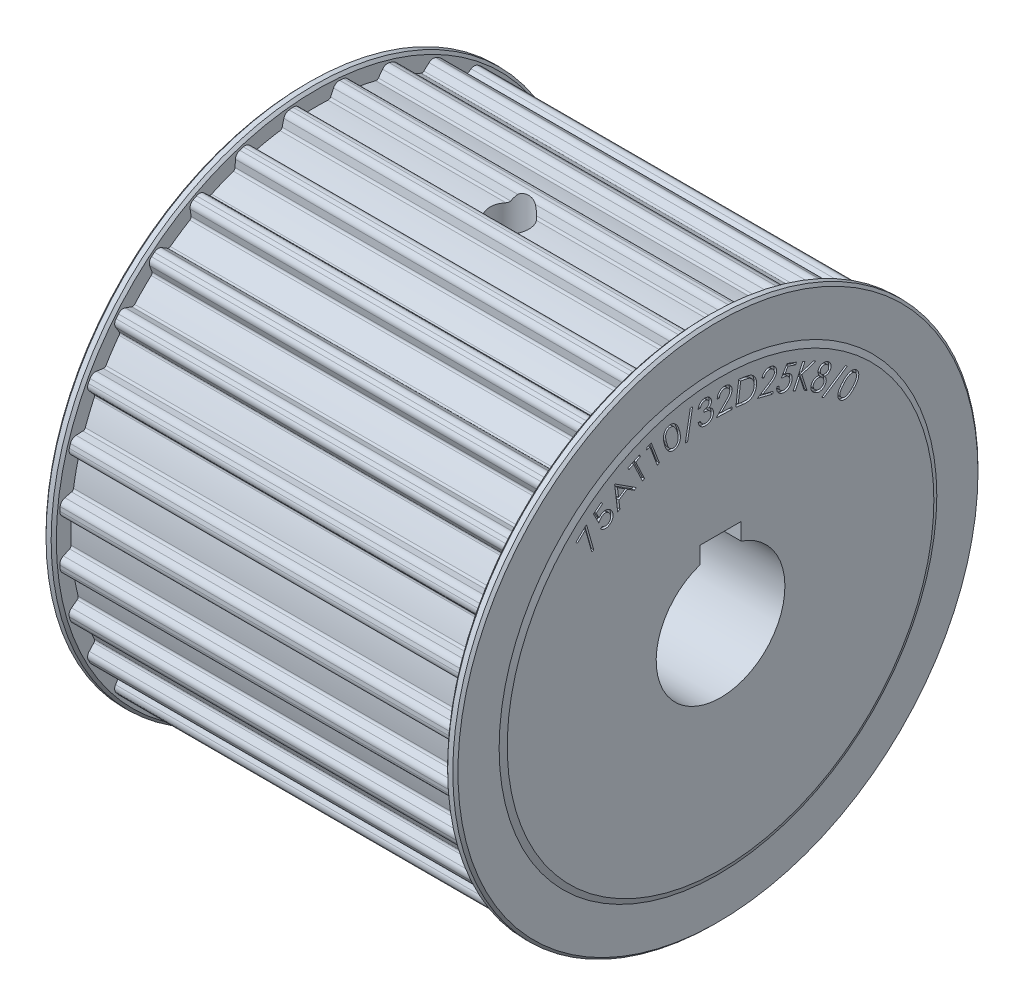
SolidWorks part; units mm, degrees
ref_plane "Front Plane" through (0, 0, 0) normal (0, 0, 1) x (1, 0, 0)
ref_plane "Top Plane" through (0, 0, 0) normal (0, 1, 0) x (1, 0, 0)
ref_plane "Right Plane" through (0, 0, 0) normal (1, 0, 0) x (0, 0, -1)
imported_body "Imported1"
sketch "Sketch1" plane through (-21, 0, 0) normal (-1, 0, 0) x (0, 0, 1)
  circle A0 centre (0, 0) radius 67.7057
extrude "Cut-Extrude1" cut sketch "Sketch1" against normal blind 0.5
sketch "Sketch2" plane through (17, 0, 0) normal (1, 0, 0) x (0, 0, -1)
  circle A0 centre (0, 0) radius 53.4254
extrude "Cut-Extrude2" cut sketch "Sketch2" against normal blind 0.5
fillet "Fillet1" radius 0.5 2 edges at (-20.5, 0, -50.5) (16.5, 0, 50.5)
ref_plane "Plane1" through (-12.5, 0, 0) normal (1, 0, 0) x (0, 0, -1)
sketch "Sketch3" plane through (-12.5, 0, 0) normal (1, 0, 0) x (0, 0, -1)
  circle A0 centre (0, 0) radius 53.7735
extrude "Cut-Extrude3" cut sketch "Sketch3" along normal blind 30
sketch "Sketch5" plane through (-12.5, 0, 0) normal (1, 0, 0) x (0, 0, -1)
  line L0 (4, 15.1427) -> (4, 11.8427) construction
  line L1 (-4, 15.1427) -> (4, 15.1427) construction
  line L2 (-4, 11.8427) -> (-4, 15.1427) construction
  line L3 (4, 15.1427) -> (4, 11.8427)
  line L4 (-4, 15.1427) -> (4, 15.1427)
  line L5 (-4, 11.8427) -> (-4, 15.1427)
  line L64 (-3.3393, -49.126) -> (-2.769, -47.903)
  line L65 (2.769, -47.903) -> (3.3393, -49.126)
  line L66 (6.3089, -48.8335) -> (6.6296, -47.5228)
  line L67 (12.0612, -46.4423) -> (12.8592, -47.5306)
  line L68 (15.7146, -46.6644) -> (15.7734, -45.3162)
  line L69 (20.8899, -43.1969) -> (21.8848, -44.1086)
  line L70 (24.5164, -42.702) -> (24.3111, -41.3683)
  line L71 (28.9158, -38.2915) -> (30.0695, -38.9916)
  line L72 (32.3761, -37.0986) -> (31.9145, -35.8305)
  line L73 (35.8305, -31.9145) -> (37.0986, -32.3761)
  line L74 (38.9916, -30.0695) -> (38.2915, -28.9158)
  line L75 (41.3683, -24.3111) -> (42.702, -24.5164)
  line L76 (44.1086, -21.8848) -> (43.1969, -20.8899)
  line L77 (45.3162, -15.7734) -> (46.6644, -15.7146)
  line L78 (47.5306, -12.8592) -> (46.4423, -12.0612)
  line L79 (47.5228, -6.6296) -> (48.8335, -6.3089)
  line L80 (49.126, -3.3393) -> (47.903, -2.769)
  line L81 (47.903, 2.769) -> (49.126, 3.3393)
  line L82 (48.8335, 6.3089) -> (47.5228, 6.6296)
  line L83 (46.4423, 12.0612) -> (47.5306, 12.8592)
  line L84 (46.6644, 15.7146) -> (45.3162, 15.7734)
  line L85 (43.1969, 20.8899) -> (44.1086, 21.8848)
  line L86 (42.702, 24.5164) -> (41.3683, 24.3111)
  line L87 (38.2915, 28.9158) -> (38.9916, 30.0695)
  line L88 (37.0986, 32.3761) -> (35.8305, 31.9145)
  line L89 (31.9145, 35.8305) -> (32.3761, 37.0986)
  line L90 (30.0695, 38.9916) -> (28.9158, 38.2915)
  line L91 (24.3111, 41.3683) -> (24.5164, 42.702)
  line L92 (21.8848, 44.1086) -> (20.8899, 43.1969)
  line L93 (15.7734, 45.3162) -> (15.7146, 46.6644)
  line L94 (12.8592, 47.5306) -> (12.0612, 46.4423)
  line L95 (6.6296, 47.5228) -> (6.3089, 48.8335)
  line L96 (3.3393, 49.126) -> (2.769, 47.903)
  line L97 (-2.769, 47.903) -> (-3.3393, 49.126)
  line L98 (-6.3089, 48.8335) -> (-6.6296, 47.5228)
  line L99 (-12.0612, 46.4423) -> (-12.8592, 47.5306)
  line L100 (-15.7146, 46.6644) -> (-15.7734, 45.3162)
  line L101 (-20.8899, 43.1969) -> (-21.8848, 44.1086)
  line L102 (-24.5164, 42.702) -> (-24.3111, 41.3683)
  line L103 (-28.9158, 38.2915) -> (-30.0695, 38.9916)
  line L104 (-32.3761, 37.0986) -> (-31.9145, 35.8305)
  line L105 (-35.8305, 31.9145) -> (-37.0986, 32.3761)
  line L106 (-38.9916, 30.0695) -> (-38.2915, 28.9158)
  line L107 (-41.3683, 24.3111) -> (-42.702, 24.5164)
  line L108 (-44.1086, 21.8848) -> (-43.1969, 20.8899)
  line L109 (-45.3162, 15.7734) -> (-46.6644, 15.7146)
  line L110 (-47.5306, 12.8592) -> (-46.4423, 12.0612)
  line L111 (-47.5228, 6.6296) -> (-48.8335, 6.3089)
  line L112 (-49.126, 3.3393) -> (-47.903, 2.769)
  line L113 (-47.903, -2.769) -> (-49.126, -3.3393)
  line L114 (-48.8335, -6.3089) -> (-47.5228, -6.6296)
  line L115 (-46.4423, -12.0612) -> (-47.5306, -12.8592)
  line L116 (-46.6644, -15.7146) -> (-45.3162, -15.7734)
  line L117 (-43.1969, -20.8899) -> (-44.1086, -21.8848)
  line L118 (-42.702, -24.5164) -> (-41.3683, -24.3111)
  line L119 (-38.2915, -28.9158) -> (-38.9916, -30.0695)
  line L120 (-37.0986, -32.3761) -> (-35.8305, -31.9145)
  line L121 (-31.9145, -35.8305) -> (-32.3761, -37.0986)
  line L122 (-30.0695, -38.9916) -> (-28.9158, -38.2915)
  line L123 (-24.3111, -41.3683) -> (-24.5164, -42.702)
  line L124 (-21.8848, -44.1086) -> (-20.8899, -43.1969)
  line L125 (-15.7734, -45.3162) -> (-15.7146, -46.6644)
  line L126 (-12.8592, -47.5306) -> (-12.0612, -46.4423)
  line L127 (-6.6296, -47.5228) -> (-6.3089, -48.8335)
  line L128 (-3.3393, -49.126) -> (-2.769, -47.903)
  line L129 (2.769, -47.903) -> (3.3393, -49.126)
  line L130 (6.3089, -48.8335) -> (6.6296, -47.5228)
  line L131 (12.0612, -46.4423) -> (12.8592, -47.5306)
  line L132 (15.7146, -46.6644) -> (15.7734, -45.3162)
  line L133 (20.8899, -43.1969) -> (21.8848, -44.1086)
  line L134 (24.5164, -42.702) -> (24.3111, -41.3683)
  line L135 (28.9158, -38.2915) -> (30.0695, -38.9916)
  line L136 (32.3761, -37.0986) -> (31.9145, -35.8305)
  line L137 (35.8305, -31.9145) -> (37.0986, -32.3761)
  line L138 (38.9916, -30.0695) -> (38.2915, -28.9158)
  line L139 (41.3683, -24.3111) -> (42.702, -24.5164)
  line L140 (44.1086, -21.8848) -> (43.1969, -20.8899)
  line L141 (45.3162, -15.7734) -> (46.6644, -15.7146)
  line L142 (47.5306, -12.8592) -> (46.4423, -12.0612)
  line L143 (47.5228, -6.6296) -> (48.8335, -6.3089)
  line L144 (49.126, -3.3393) -> (47.903, -2.769)
  line L145 (47.903, 2.769) -> (49.126, 3.3393)
  line L146 (48.8335, 6.3089) -> (47.5228, 6.6296)
  line L147 (46.4423, 12.0612) -> (47.5306, 12.8592)
  line L148 (46.6644, 15.7146) -> (45.3162, 15.7734)
  line L149 (43.1969, 20.8899) -> (44.1086, 21.8848)
  line L150 (42.702, 24.5164) -> (41.3683, 24.3111)
  line L151 (38.2915, 28.9158) -> (38.9916, 30.0695)
  line L152 (37.0986, 32.3761) -> (35.8305, 31.9145)
  line L153 (31.9145, 35.8305) -> (32.3761, 37.0986)
  line L154 (30.0695, 38.9916) -> (28.9158, 38.2915)
  line L155 (24.3111, 41.3683) -> (24.5164, 42.702)
  line L156 (21.8848, 44.1086) -> (20.8899, 43.1969)
  line L157 (15.7734, 45.3162) -> (15.7146, 46.6644)
  line L158 (12.8592, 47.5306) -> (12.0612, 46.4423)
  line L159 (6.6296, 47.5228) -> (6.3089, 48.8335)
  line L160 (3.3393, 49.126) -> (2.769, 47.903)
  line L161 (-2.769, 47.903) -> (-3.3393, 49.126)
  line L162 (-6.3089, 48.8335) -> (-6.6296, 47.5228)
  line L163 (-12.0612, 46.4423) -> (-12.8592, 47.5306)
  line L164 (-15.7146, 46.6644) -> (-15.7734, 45.3162)
  line L165 (-20.8899, 43.1969) -> (-21.8848, 44.1086)
  line L166 (-24.5164, 42.702) -> (-24.3111, 41.3683)
  line L167 (-28.9158, 38.2915) -> (-30.0695, 38.9916)
  line L168 (-32.3761, 37.0986) -> (-31.9145, 35.8305)
  line L169 (-35.8305, 31.9145) -> (-37.0986, 32.3761)
  line L170 (-38.9916, 30.0695) -> (-38.2915, 28.9158)
  line L171 (-41.3683, 24.3111) -> (-42.702, 24.5164)
  line L172 (-44.1086, 21.8848) -> (-43.1969, 20.8899)
  line L173 (-45.3162, 15.7734) -> (-46.6644, 15.7146)
  line L174 (-47.5306, 12.8592) -> (-46.4423, 12.0612)
  line L175 (-47.5228, 6.6296) -> (-48.8335, 6.3089)
  line L176 (-49.126, 3.3393) -> (-47.903, 2.769)
  line L177 (-47.903, -2.769) -> (-49.126, -3.3393)
  line L178 (-48.8335, -6.3089) -> (-47.5228, -6.6296)
  line L179 (-46.4423, -12.0612) -> (-47.5306, -12.8592)
  line L180 (-46.6644, -15.7146) -> (-45.3162, -15.7734)
  line L181 (-43.1969, -20.8899) -> (-44.1086, -21.8848)
  line L182 (-42.702, -24.5164) -> (-41.3683, -24.3111)
  line L183 (-38.2915, -28.9158) -> (-38.9916, -30.0695)
  line L184 (-37.0986, -32.3761) -> (-35.8305, -31.9145)
  line L185 (-31.9145, -35.8305) -> (-32.3761, -37.0986)
  line L186 (-30.0695, -38.9916) -> (-28.9158, -38.2915)
  line L187 (-24.3111, -41.3683) -> (-24.5164, -42.702)
  line L188 (-21.8848, -44.1086) -> (-20.8899, -43.1969)
  line L189 (-15.7734, -45.3162) -> (-15.7146, -46.6644)
  line L190 (-12.8592, -47.5306) -> (-12.0612, -46.4423)
  line L191 (-6.6296, -47.5228) -> (-6.3089, -48.8335)
  arc A0 (-4, 11.8427) -> (4, 11.8427) centre (0, 0) ccw construction
  arc A1 (-4, 11.8427) -> (4, 11.8427) centre (0, 0) ccw
  arc A192 (-2.2918, -47.6149) -> (-2.769, -47.903) centre (-2.3159, -48.1143) ccw
  arc A193 (-2.2918, -47.6149) -> (2.2918, -47.6149) centre (0, 0) ccw
  arc A194 (2.769, -47.903) -> (2.2918, -47.6149) centre (2.3159, -48.1143) ccw
  arc A195 (3.3393, -49.126) -> (4.5357, -49.8139) centre (4.4269, -48.6189) ccw
  arc A196 (4.5357, -49.8139) -> (5.2697, -49.7416) centre (0, 0) ccw
  arc A197 (5.2697, -49.7416) -> (6.3089, -48.8335) centre (5.1432, -48.5483) ccw
  arc A198 (7.0414, -47.1471) -> (6.6296, -47.5228) centre (7.1153, -47.6416) ccw
  arc A199 (7.0414, -47.1471) -> (11.537, -46.2529) centre (0, 0) ccw
  arc A200 (12.0612, -46.4423) -> (11.537, -46.2529) centre (11.658, -46.738) ccw
  arc A201 (12.8592, -47.5306) -> (14.1668, -47.9719) centre (13.8269, -46.821) ccw
  arc A202 (14.1668, -47.9719) -> (14.8725, -47.7578) centre (0, 0) ccw
  arc A203 (14.8725, -47.7578) -> (15.7146, -46.6644) centre (14.5157, -46.6121) ccw
  arc A204 (16.1041, -44.8675) -> (15.7734, -45.3162) centre (16.273, -45.3381) ccw
  arc A205 (16.1041, -44.8675) -> (20.3388, -43.1134) centre (0, 0) ccw
  arc A206 (20.8899, -43.1969) -> (20.3388, -43.1134) centre (20.5521, -43.5656) ccw
  arc A207 (21.8848, -44.1086) -> (23.2534, -44.2863) centre (22.6956, -43.2239) ccw
  arc A208 (23.2534, -44.2863) -> (23.9038, -43.9387) centre (0, 0) ccw
  arc A209 (23.9038, -43.9387) -> (24.5164, -42.702) centre (23.3304, -42.8846) ccw
  arc A210 (24.5478, -40.8636) -> (24.3111, -41.3683) centre (24.8053, -41.2922) ccw
  arc A211 (24.5478, -40.8636) -> (28.359, -38.3171) centre (0, 0) ccw
  arc A212 (28.9158, -38.2915) -> (28.359, -38.3171) centre (28.6564, -38.719) ccw
  arc A213 (30.0695, -38.9916) -> (31.4464, -38.8989) centre (30.692, -37.9657) ccw
  arc A214 (31.4464, -38.8989) -> (32.0165, -38.431) centre (0, 0) ccw
  arc A215 (32.0165, -38.431) -> (32.3761, -37.0986) centre (31.2485, -37.509) ccw
  arc A216 (32.0482, -35.2894) -> (31.9145, -35.8305) centre (32.3844, -35.6595) ccw
  arc A217 (32.0482, -35.2894) -> (35.2894, -32.0482) centre (0, 0) ccw
  arc A218 (35.8305, -31.9145) -> (35.2894, -32.0482) centre (35.6595, -32.3844) ccw
  arc A219 (37.0986, -32.3761) -> (38.431, -32.0165) centre (37.509, -31.2485) ccw
  arc A220 (38.431, -32.0165) -> (38.8989, -31.4464) centre (0, 0) ccw
  arc A221 (38.8989, -31.4464) -> (38.9916, -30.0695) centre (37.9657, -30.692) ccw
  arc A222 (38.3171, -28.359) -> (38.2915, -28.9158) centre (38.719, -28.6564) ccw
  arc A223 (38.3171, -28.359) -> (40.8636, -24.5478) centre (0, 0) ccw
  arc A224 (41.3683, -24.3111) -> (40.8636, -24.5478) centre (41.2922, -24.8053) ccw
  arc A225 (42.702, -24.5164) -> (43.9387, -23.9038) centre (42.8846, -23.3304) ccw
  arc A226 (43.9387, -23.9038) -> (44.2863, -23.2534) centre (0, 0) ccw
  arc A227 (44.2863, -23.2534) -> (44.1086, -21.8848) centre (43.2239, -22.6956) ccw
  arc A228 (43.1134, -20.3388) -> (43.1969, -20.8899) centre (43.5656, -20.5521) ccw
  arc A229 (43.1134, -20.3388) -> (44.8675, -16.1041) centre (0, 0) ccw
  arc A230 (45.3162, -15.7734) -> (44.8675, -16.1041) centre (45.3381, -16.273) ccw
  arc A231 (46.6644, -15.7146) -> (47.7578, -14.8725) centre (46.6121, -14.5157) ccw
  arc A232 (47.7578, -14.8725) -> (47.9719, -14.1668) centre (0, 0) ccw
  arc A233 (47.9719, -14.1668) -> (47.5306, -12.8592) centre (46.821, -13.8269) ccw
  arc A234 (46.2529, -11.537) -> (46.4423, -12.0612) centre (46.738, -11.658) ccw
  arc A235 (46.2529, -11.537) -> (47.1471, -7.0414) centre (0, 0) ccw
  arc A236 (47.5228, -6.6296) -> (47.1471, -7.0414) centre (47.6416, -7.1153) ccw
  arc A237 (48.8335, -6.3089) -> (49.7416, -5.2697) centre (48.5483, -5.1432) ccw
  arc A238 (49.7416, -5.2697) -> (49.8139, -4.5357) centre (0, 0) ccw
  arc A239 (49.8139, -4.5357) -> (49.126, -3.3393) centre (48.6189, -4.4269) ccw
  arc A240 (47.6149, -2.2918) -> (47.903, -2.769) centre (48.1143, -2.3159) ccw
  arc A241 (47.6149, -2.2918) -> (47.6149, 2.2918) centre (0, 0) ccw
  arc A242 (47.903, 2.769) -> (47.6149, 2.2918) centre (48.1143, 2.3159) ccw
  arc A243 (49.126, 3.3393) -> (49.8139, 4.5357) centre (48.6189, 4.4269) ccw
  arc A244 (49.8139, 4.5357) -> (49.7416, 5.2697) centre (0, 0) ccw
  arc A245 (49.7416, 5.2697) -> (48.8335, 6.3089) centre (48.5483, 5.1432) ccw
  arc A246 (47.1471, 7.0414) -> (47.5228, 6.6296) centre (47.6416, 7.1153) ccw
  arc A247 (47.1471, 7.0414) -> (46.2529, 11.537) centre (0, 0) ccw
  arc A248 (46.4423, 12.0612) -> (46.2529, 11.537) centre (46.738, 11.658) ccw
  arc A249 (47.5306, 12.8592) -> (47.9719, 14.1668) centre (46.821, 13.8269) ccw
  arc A250 (47.9719, 14.1668) -> (47.7578, 14.8725) centre (0, 0) ccw
  arc A251 (47.7578, 14.8725) -> (46.6644, 15.7146) centre (46.6121, 14.5157) ccw
  arc A252 (44.8675, 16.1041) -> (45.3162, 15.7734) centre (45.3381, 16.273) ccw
  arc A253 (44.8675, 16.1041) -> (43.1134, 20.3388) centre (0, 0) ccw
  arc A254 (43.1969, 20.8899) -> (43.1134, 20.3388) centre (43.5656, 20.5521) ccw
  arc A255 (44.1086, 21.8848) -> (44.2863, 23.2534) centre (43.2239, 22.6956) ccw
  arc A256 (44.2863, 23.2534) -> (43.9387, 23.9038) centre (0, 0) ccw
  arc A257 (43.9387, 23.9038) -> (42.702, 24.5164) centre (42.8846, 23.3304) ccw
  arc A258 (40.8636, 24.5478) -> (41.3683, 24.3111) centre (41.2922, 24.8053) ccw
  arc A259 (40.8636, 24.5478) -> (38.3171, 28.359) centre (0, 0) ccw
  arc A260 (38.2915, 28.9158) -> (38.3171, 28.359) centre (38.719, 28.6564) ccw
  arc A261 (38.9916, 30.0695) -> (38.8989, 31.4464) centre (37.9657, 30.692) ccw
  arc A262 (38.8989, 31.4464) -> (38.431, 32.0165) centre (0, 0) ccw
  arc A263 (38.431, 32.0165) -> (37.0986, 32.3761) centre (37.509, 31.2485) ccw
  arc A264 (35.2894, 32.0482) -> (35.8305, 31.9145) centre (35.6595, 32.3844) ccw
  arc A265 (35.2894, 32.0482) -> (32.0482, 35.2894) centre (0, 0) ccw
  arc A266 (31.9145, 35.8305) -> (32.0482, 35.2894) centre (32.3844, 35.6595) ccw
  arc A267 (32.3761, 37.0986) -> (32.0165, 38.431) centre (31.2485, 37.509) ccw
  arc A268 (32.0165, 38.431) -> (31.4464, 38.8989) centre (0, 0) ccw
  arc A269 (31.4464, 38.8989) -> (30.0695, 38.9916) centre (30.692, 37.9657) ccw
  arc A270 (28.359, 38.3171) -> (28.9158, 38.2915) centre (28.6564, 38.719) ccw
  arc A271 (28.359, 38.3171) -> (24.5478, 40.8636) centre (0, 0) ccw
  arc A272 (24.3111, 41.3683) -> (24.5478, 40.8636) centre (24.8053, 41.2922) ccw
  arc A273 (24.5164, 42.702) -> (23.9038, 43.9387) centre (23.3304, 42.8846) ccw
  arc A274 (23.9038, 43.9387) -> (23.2534, 44.2863) centre (0, 0) ccw
  arc A275 (23.2534, 44.2863) -> (21.8848, 44.1086) centre (22.6956, 43.2239) ccw
  arc A276 (20.3388, 43.1134) -> (20.8899, 43.1969) centre (20.5521, 43.5656) ccw
  arc A277 (20.3388, 43.1134) -> (16.1041, 44.8675) centre (0, 0) ccw
  arc A278 (15.7734, 45.3162) -> (16.1041, 44.8675) centre (16.273, 45.3381) ccw
  arc A279 (15.7146, 46.6644) -> (14.8725, 47.7578) centre (14.5157, 46.6121) ccw
  arc A280 (14.8725, 47.7578) -> (14.1668, 47.9719) centre (0, 0) ccw
  arc A281 (14.1668, 47.9719) -> (12.8592, 47.5306) centre (13.8269, 46.821) ccw
  arc A282 (11.537, 46.2529) -> (12.0612, 46.4423) centre (11.658, 46.738) ccw
  arc A283 (11.537, 46.2529) -> (7.0414, 47.1471) centre (0, 0) ccw
  arc A284 (6.6296, 47.5228) -> (7.0414, 47.1471) centre (7.1153, 47.6416) ccw
  arc A285 (6.3089, 48.8335) -> (5.2697, 49.7416) centre (5.1432, 48.5483) ccw
  arc A286 (5.2697, 49.7416) -> (4.5357, 49.8139) centre (0, 0) ccw
  arc A287 (4.5357, 49.8139) -> (3.3393, 49.126) centre (4.4269, 48.6189) ccw
  arc A288 (2.2918, 47.6149) -> (2.769, 47.903) centre (2.3159, 48.1143) ccw
  arc A289 (2.2918, 47.6149) -> (-2.2918, 47.6149) centre (0, 0) ccw
  arc A290 (-2.769, 47.903) -> (-2.2918, 47.6149) centre (-2.3159, 48.1143) ccw
  arc A291 (-3.3393, 49.126) -> (-4.5357, 49.8139) centre (-4.4269, 48.6189) ccw
  arc A292 (-4.5357, 49.8139) -> (-5.2697, 49.7416) centre (0, 0) ccw
  arc A293 (-5.2697, 49.7416) -> (-6.3089, 48.8335) centre (-5.1432, 48.5483) ccw
  arc A294 (-7.0414, 47.1471) -> (-6.6296, 47.5228) centre (-7.1153, 47.6416) ccw
  arc A295 (-7.0414, 47.1471) -> (-11.537, 46.2529) centre (0, 0) ccw
  arc A296 (-12.0612, 46.4423) -> (-11.537, 46.2529) centre (-11.658, 46.738) ccw
  arc A297 (-12.8592, 47.5306) -> (-14.1668, 47.9719) centre (-13.8269, 46.821) ccw
  arc A298 (-14.1668, 47.9719) -> (-14.8725, 47.7578) centre (0, 0) ccw
  arc A299 (-14.8725, 47.7578) -> (-15.7146, 46.6644) centre (-14.5157, 46.6121) ccw
  arc A300 (-16.1041, 44.8675) -> (-15.7734, 45.3162) centre (-16.273, 45.3381) ccw
  arc A301 (-16.1041, 44.8675) -> (-20.3388, 43.1134) centre (0, 0) ccw
  arc A302 (-20.8899, 43.1969) -> (-20.3388, 43.1134) centre (-20.5521, 43.5656) ccw
  arc A303 (-21.8848, 44.1086) -> (-23.2534, 44.2863) centre (-22.6956, 43.2239) ccw
  arc A304 (-23.2534, 44.2863) -> (-23.9038, 43.9387) centre (0, 0) ccw
  arc A305 (-23.9038, 43.9387) -> (-24.5164, 42.702) centre (-23.3304, 42.8846) ccw
  arc A306 (-24.5478, 40.8636) -> (-24.3111, 41.3683) centre (-24.8053, 41.2922) ccw
  arc A307 (-24.5478, 40.8636) -> (-28.359, 38.3171) centre (0, 0) ccw
  arc A308 (-28.9158, 38.2915) -> (-28.359, 38.3171) centre (-28.6564, 38.719) ccw
  arc A309 (-30.0695, 38.9916) -> (-31.4464, 38.8989) centre (-30.692, 37.9657) ccw
  arc A310 (-31.4464, 38.8989) -> (-32.0165, 38.431) centre (0, 0) ccw
  arc A311 (-32.0165, 38.431) -> (-32.3761, 37.0986) centre (-31.2485, 37.509) ccw
  arc A312 (-32.0482, 35.2894) -> (-31.9145, 35.8305) centre (-32.3844, 35.6595) ccw
  arc A313 (-32.0482, 35.2894) -> (-35.2894, 32.0482) centre (0, 0) ccw
  arc A314 (-35.8305, 31.9145) -> (-35.2894, 32.0482) centre (-35.6595, 32.3844) ccw
  arc A315 (-37.0986, 32.3761) -> (-38.431, 32.0165) centre (-37.509, 31.2485) ccw
  arc A316 (-38.431, 32.0165) -> (-38.8989, 31.4464) centre (0, 0) ccw
  arc A317 (-38.8989, 31.4464) -> (-38.9916, 30.0695) centre (-37.9657, 30.692) ccw
  arc A318 (-38.3171, 28.359) -> (-38.2915, 28.9158) centre (-38.719, 28.6564) ccw
  arc A319 (-38.3171, 28.359) -> (-40.8636, 24.5478) centre (0, 0) ccw
  arc A320 (-41.3683, 24.3111) -> (-40.8636, 24.5478) centre (-41.2922, 24.8053) ccw
  arc A321 (-42.702, 24.5164) -> (-43.9387, 23.9038) centre (-42.8846, 23.3304) ccw
  arc A322 (-43.9387, 23.9038) -> (-44.2863, 23.2534) centre (0, 0) ccw
  arc A323 (-44.2863, 23.2534) -> (-44.1086, 21.8848) centre (-43.2239, 22.6956) ccw
  arc A324 (-43.1134, 20.3388) -> (-43.1969, 20.8899) centre (-43.5656, 20.5521) ccw
  arc A325 (-43.1134, 20.3388) -> (-44.8675, 16.1041) centre (0, 0) ccw
  arc A326 (-45.3162, 15.7734) -> (-44.8675, 16.1041) centre (-45.3381, 16.273) ccw
  arc A327 (-46.6644, 15.7146) -> (-47.7578, 14.8725) centre (-46.6121, 14.5157) ccw
  arc A328 (-47.7578, 14.8725) -> (-47.9719, 14.1668) centre (0, 0) ccw
  arc A329 (-47.9719, 14.1668) -> (-47.5306, 12.8592) centre (-46.821, 13.8269) ccw
  arc A330 (-46.2529, 11.537) -> (-46.4423, 12.0612) centre (-46.738, 11.658) ccw
  arc A331 (-46.2529, 11.537) -> (-47.1471, 7.0414) centre (0, 0) ccw
  arc A332 (-47.5228, 6.6296) -> (-47.1471, 7.0414) centre (-47.6416, 7.1153) ccw
  arc A333 (-48.8335, 6.3089) -> (-49.7416, 5.2697) centre (-48.5483, 5.1432) ccw
  arc A334 (-49.7416, 5.2697) -> (-49.8139, 4.5357) centre (0, 0) ccw
  arc A335 (-49.8139, 4.5357) -> (-49.126, 3.3393) centre (-48.6189, 4.4269) ccw
  arc A336 (-47.6149, 2.2918) -> (-47.903, 2.769) centre (-48.1143, 2.3159) ccw
  arc A337 (-47.6149, 2.2918) -> (-47.6149, -2.2918) centre (0, 0) ccw
  arc A338 (-47.903, -2.769) -> (-47.6149, -2.2918) centre (-48.1143, -2.3159) ccw
  arc A339 (-49.126, -3.3393) -> (-49.8139, -4.5357) centre (-48.6189, -4.4269) ccw
  arc A340 (-49.8139, -4.5357) -> (-49.7416, -5.2697) centre (0, 0) ccw
  arc A341 (-49.7416, -5.2697) -> (-48.8335, -6.3089) centre (-48.5483, -5.1432) ccw
  arc A342 (-47.1471, -7.0414) -> (-47.5228, -6.6296) centre (-47.6416, -7.1153) ccw
  arc A343 (-47.1471, -7.0414) -> (-46.2529, -11.537) centre (0, 0) ccw
  arc A344 (-46.4423, -12.0612) -> (-46.2529, -11.537) centre (-46.738, -11.658) ccw
  arc A345 (-47.5306, -12.8592) -> (-47.9719, -14.1668) centre (-46.821, -13.8269) ccw
  arc A346 (-47.9719, -14.1668) -> (-47.7578, -14.8725) centre (0, 0) ccw
  arc A347 (-47.7578, -14.8725) -> (-46.6644, -15.7146) centre (-46.6121, -14.5157) ccw
  arc A348 (-44.8675, -16.1041) -> (-45.3162, -15.7734) centre (-45.3381, -16.273) ccw
  arc A349 (-44.8675, -16.1041) -> (-43.1134, -20.3388) centre (0, 0) ccw
  arc A350 (-43.1969, -20.8899) -> (-43.1134, -20.3388) centre (-43.5656, -20.5521) ccw
  arc A351 (-44.1086, -21.8848) -> (-44.2863, -23.2534) centre (-43.2239, -22.6956) ccw
  arc A352 (-44.2863, -23.2534) -> (-43.9387, -23.9038) centre (0, 0) ccw
  arc A353 (-43.9387, -23.9038) -> (-42.702, -24.5164) centre (-42.8846, -23.3304) ccw
  arc A354 (-40.8636, -24.5478) -> (-41.3683, -24.3111) centre (-41.2922, -24.8053) ccw
  arc A355 (-40.8636, -24.5478) -> (-38.3171, -28.359) centre (0, 0) ccw
  arc A356 (-38.2915, -28.9158) -> (-38.3171, -28.359) centre (-38.719, -28.6564) ccw
  arc A357 (-38.9916, -30.0695) -> (-38.8989, -31.4464) centre (-37.9657, -30.692) ccw
  arc A358 (-38.8989, -31.4464) -> (-38.431, -32.0165) centre (0, 0) ccw
  arc A359 (-38.431, -32.0165) -> (-37.0986, -32.3761) centre (-37.509, -31.2485) ccw
  arc A360 (-35.2894, -32.0482) -> (-35.8305, -31.9145) centre (-35.6595, -32.3844) ccw
  arc A361 (-35.2894, -32.0482) -> (-32.0482, -35.2894) centre (0, 0) ccw
  arc A362 (-31.9145, -35.8305) -> (-32.0482, -35.2894) centre (-32.3844, -35.6595) ccw
  arc A363 (-32.3761, -37.0986) -> (-32.0165, -38.431) centre (-31.2485, -37.509) ccw
  arc A364 (-32.0165, -38.431) -> (-31.4464, -38.8989) centre (0, 0) ccw
  arc A365 (-31.4464, -38.8989) -> (-30.0695, -38.9916) centre (-30.692, -37.9657) ccw
  arc A366 (-28.359, -38.3171) -> (-28.9158, -38.2915) centre (-28.6564, -38.719) ccw
  arc A367 (-28.359, -38.3171) -> (-24.5478, -40.8636) centre (0, 0) ccw
  arc A368 (-24.3111, -41.3683) -> (-24.5478, -40.8636) centre (-24.8053, -41.2922) ccw
  arc A369 (-24.5164, -42.702) -> (-23.9038, -43.9387) centre (-23.3304, -42.8846) ccw
  arc A370 (-23.9038, -43.9387) -> (-23.2534, -44.2863) centre (0, 0) ccw
  arc A371 (-23.2534, -44.2863) -> (-21.8848, -44.1086) centre (-22.6956, -43.2239) ccw
  arc A372 (-20.3388, -43.1134) -> (-20.8899, -43.1969) centre (-20.5521, -43.5656) ccw
  arc A373 (-20.3388, -43.1134) -> (-16.1041, -44.8675) centre (0, 0) ccw
  arc A374 (-15.7734, -45.3162) -> (-16.1041, -44.8675) centre (-16.273, -45.3381) ccw
  arc A375 (-15.7146, -46.6644) -> (-14.8725, -47.7578) centre (-14.5157, -46.6121) ccw
  arc A376 (-14.8725, -47.7578) -> (-14.1668, -47.9719) centre (0, 0) ccw
  arc A377 (-14.1668, -47.9719) -> (-12.8592, -47.5306) centre (-13.8269, -46.821) ccw
  arc A378 (-11.537, -46.2529) -> (-12.0612, -46.4423) centre (-11.658, -46.738) ccw
  arc A379 (-11.537, -46.2529) -> (-7.0414, -47.1471) centre (0, 0) ccw
  arc A380 (-6.6296, -47.5228) -> (-7.0414, -47.1471) centre (-7.1153, -47.6416) ccw
  arc A381 (-6.3089, -48.8335) -> (-5.2697, -49.7416) centre (-5.1432, -48.5483) ccw
  arc A382 (-5.2697, -49.7416) -> (-4.5357, -49.8139) centre (0, 0) ccw
  arc A383 (-4.5357, -49.8139) -> (-3.3393, -49.126) centre (-4.4269, -48.6189) ccw
  arc A384 (-2.2918, -47.6149) -> (-2.769, -47.903) centre (-2.3159, -48.1143) ccw
  arc A385 (-2.2918, -47.6149) -> (2.2918, -47.6149) centre (0, 0) ccw
  arc A386 (2.769, -47.903) -> (2.2918, -47.6149) centre (2.3159, -48.1143) ccw
  arc A387 (3.3393, -49.126) -> (4.5357, -49.8139) centre (4.4269, -48.6189) ccw
  arc A388 (4.5357, -49.8139) -> (5.2697, -49.7416) centre (0, 0) ccw
  arc A389 (5.2697, -49.7416) -> (6.3089, -48.8335) centre (5.1432, -48.5483) ccw
  arc A390 (7.0414, -47.1471) -> (6.6296, -47.5228) centre (7.1153, -47.6416) ccw
  arc A391 (7.0414, -47.1471) -> (11.537, -46.2529) centre (0, 0) ccw
  arc A392 (12.0612, -46.4423) -> (11.537, -46.2529) centre (11.658, -46.738) ccw
  arc A393 (12.8592, -47.5306) -> (14.1668, -47.9719) centre (13.8269, -46.821) ccw
  arc A394 (14.1668, -47.9719) -> (14.8725, -47.7578) centre (0, 0) ccw
  arc A395 (14.8725, -47.7578) -> (15.7146, -46.6644) centre (14.5157, -46.6121) ccw
  arc A396 (16.1041, -44.8675) -> (15.7734, -45.3162) centre (16.273, -45.3381) ccw
  arc A397 (16.1041, -44.8675) -> (20.3388, -43.1134) centre (0, 0) ccw
  arc A398 (20.8899, -43.1969) -> (20.3388, -43.1134) centre (20.5521, -43.5656) ccw
  arc A399 (21.8848, -44.1086) -> (23.2534, -44.2863) centre (22.6956, -43.2239) ccw
  arc A400 (23.2534, -44.2863) -> (23.9038, -43.9387) centre (0, 0) ccw
  arc A401 (23.9038, -43.9387) -> (24.5164, -42.702) centre (23.3304, -42.8846) ccw
  arc A402 (24.5478, -40.8636) -> (24.3111, -41.3683) centre (24.8053, -41.2922) ccw
  arc A403 (24.5478, -40.8636) -> (28.359, -38.3171) centre (0, 0) ccw
  arc A404 (28.9158, -38.2915) -> (28.359, -38.3171) centre (28.6564, -38.719) ccw
  arc A405 (30.0695, -38.9916) -> (31.4464, -38.8989) centre (30.692, -37.9657) ccw
  arc A406 (31.4464, -38.8989) -> (32.0165, -38.431) centre (0, 0) ccw
  arc A407 (32.0165, -38.431) -> (32.3761, -37.0986) centre (31.2485, -37.509) ccw
  arc A408 (32.0482, -35.2894) -> (31.9145, -35.8305) centre (32.3844, -35.6595) ccw
  arc A409 (32.0482, -35.2894) -> (35.2894, -32.0482) centre (0, 0) ccw
  arc A410 (35.8305, -31.9145) -> (35.2894, -32.0482) centre (35.6595, -32.3844) ccw
  arc A411 (37.0986, -32.3761) -> (38.431, -32.0165) centre (37.509, -31.2485) ccw
  arc A412 (38.431, -32.0165) -> (38.8989, -31.4464) centre (0, 0) ccw
  arc A413 (38.8989, -31.4464) -> (38.9916, -30.0695) centre (37.9657, -30.692) ccw
  arc A414 (38.3171, -28.359) -> (38.2915, -28.9158) centre (38.719, -28.6564) ccw
  arc A415 (38.3171, -28.359) -> (40.8636, -24.5478) centre (0, 0) ccw
  arc A416 (41.3683, -24.3111) -> (40.8636, -24.5478) centre (41.2922, -24.8053) ccw
  arc A417 (42.702, -24.5164) -> (43.9387, -23.9038) centre (42.8846, -23.3304) ccw
  arc A418 (43.9387, -23.9038) -> (44.2863, -23.2534) centre (0, 0) ccw
  arc A419 (44.2863, -23.2534) -> (44.1086, -21.8848) centre (43.2239, -22.6956) ccw
  arc A420 (43.1134, -20.3388) -> (43.1969, -20.8899) centre (43.5656, -20.5521) ccw
  arc A421 (43.1134, -20.3388) -> (44.8675, -16.1041) centre (0, 0) ccw
  arc A422 (45.3162, -15.7734) -> (44.8675, -16.1041) centre (45.3381, -16.273) ccw
  arc A423 (46.6644, -15.7146) -> (47.7578, -14.8725) centre (46.6121, -14.5157) ccw
  arc A424 (47.7578, -14.8725) -> (47.9719, -14.1668) centre (0, 0) ccw
  arc A425 (47.9719, -14.1668) -> (47.5306, -12.8592) centre (46.821, -13.8269) ccw
  arc A426 (46.2529, -11.537) -> (46.4423, -12.0612) centre (46.738, -11.658) ccw
  arc A427 (46.2529, -11.537) -> (47.1471, -7.0414) centre (0, 0) ccw
  arc A428 (47.5228, -6.6296) -> (47.1471, -7.0414) centre (47.6416, -7.1153) ccw
  arc A429 (48.8335, -6.3089) -> (49.7416, -5.2697) centre (48.5483, -5.1432) ccw
  arc A430 (49.7416, -5.2697) -> (49.8139, -4.5357) centre (0, 0) ccw
  arc A431 (49.8139, -4.5357) -> (49.126, -3.3393) centre (48.6189, -4.4269) ccw
  arc A432 (47.6149, -2.2918) -> (47.903, -2.769) centre (48.1143, -2.3159) ccw
  arc A433 (47.6149, -2.2918) -> (47.6149, 2.2918) centre (0, 0) ccw
  arc A434 (47.903, 2.769) -> (47.6149, 2.2918) centre (48.1143, 2.3159) ccw
  arc A435 (49.126, 3.3393) -> (49.8139, 4.5357) centre (48.6189, 4.4269) ccw
  arc A436 (49.8139, 4.5357) -> (49.7416, 5.2697) centre (0, 0) ccw
  arc A437 (49.7416, 5.2697) -> (48.8335, 6.3089) centre (48.5483, 5.1432) ccw
  arc A438 (47.1471, 7.0414) -> (47.5228, 6.6296) centre (47.6416, 7.1153) ccw
  arc A439 (47.1471, 7.0414) -> (46.2529, 11.537) centre (0, 0) ccw
  arc A440 (46.4423, 12.0612) -> (46.2529, 11.537) centre (46.738, 11.658) ccw
  arc A441 (47.5306, 12.8592) -> (47.9719, 14.1668) centre (46.821, 13.8269) ccw
  arc A442 (47.9719, 14.1668) -> (47.7578, 14.8725) centre (0, 0) ccw
  arc A443 (47.7578, 14.8725) -> (46.6644, 15.7146) centre (46.6121, 14.5157) ccw
  arc A444 (44.8675, 16.1041) -> (45.3162, 15.7734) centre (45.3381, 16.273) ccw
  arc A445 (44.8675, 16.1041) -> (43.1134, 20.3388) centre (0, 0) ccw
  arc A446 (43.1969, 20.8899) -> (43.1134, 20.3388) centre (43.5656, 20.5521) ccw
  arc A447 (44.1086, 21.8848) -> (44.2863, 23.2534) centre (43.2239, 22.6956) ccw
  arc A448 (44.2863, 23.2534) -> (43.9387, 23.9038) centre (0, 0) ccw
  arc A449 (43.9387, 23.9038) -> (42.702, 24.5164) centre (42.8846, 23.3304) ccw
  arc A450 (40.8636, 24.5478) -> (41.3683, 24.3111) centre (41.2922, 24.8053) ccw
  arc A451 (40.8636, 24.5478) -> (38.3171, 28.359) centre (0, 0) ccw
  arc A452 (38.2915, 28.9158) -> (38.3171, 28.359) centre (38.719, 28.6564) ccw
  arc A453 (38.9916, 30.0695) -> (38.8989, 31.4464) centre (37.9657, 30.692) ccw
  arc A454 (38.8989, 31.4464) -> (38.431, 32.0165) centre (0, 0) ccw
  arc A455 (38.431, 32.0165) -> (37.0986, 32.3761) centre (37.509, 31.2485) ccw
  arc A456 (35.2894, 32.0482) -> (35.8305, 31.9145) centre (35.6595, 32.3844) ccw
  arc A457 (35.2894, 32.0482) -> (32.0482, 35.2894) centre (0, 0) ccw
  arc A458 (31.9145, 35.8305) -> (32.0482, 35.2894) centre (32.3844, 35.6595) ccw
  arc A459 (32.3761, 37.0986) -> (32.0165, 38.431) centre (31.2485, 37.509) ccw
  arc A460 (32.0165, 38.431) -> (31.4464, 38.8989) centre (0, 0) ccw
  arc A461 (31.4464, 38.8989) -> (30.0695, 38.9916) centre (30.692, 37.9657) ccw
  arc A462 (28.359, 38.3171) -> (28.9158, 38.2915) centre (28.6564, 38.719) ccw
  arc A463 (28.359, 38.3171) -> (24.5478, 40.8636) centre (0, 0) ccw
  arc A464 (24.3111, 41.3683) -> (24.5478, 40.8636) centre (24.8053, 41.2922) ccw
  arc A465 (24.5164, 42.702) -> (23.9038, 43.9387) centre (23.3304, 42.8846) ccw
  arc A466 (23.9038, 43.9387) -> (23.2534, 44.2863) centre (0, 0) ccw
  arc A467 (23.2534, 44.2863) -> (21.8848, 44.1086) centre (22.6956, 43.2239) ccw
  arc A468 (20.3388, 43.1134) -> (20.8899, 43.1969) centre (20.5521, 43.5656) ccw
  arc A469 (20.3388, 43.1134) -> (16.1041, 44.8675) centre (0, 0) ccw
  arc A470 (15.7734, 45.3162) -> (16.1041, 44.8675) centre (16.273, 45.3381) ccw
  arc A471 (15.7146, 46.6644) -> (14.8725, 47.7578) centre (14.5157, 46.6121) ccw
  arc A472 (14.8725, 47.7578) -> (14.1668, 47.9719) centre (0, 0) ccw
  arc A473 (14.1668, 47.9719) -> (12.8592, 47.5306) centre (13.8269, 46.821) ccw
  arc A474 (11.537, 46.2529) -> (12.0612, 46.4423) centre (11.658, 46.738) ccw
  arc A475 (11.537, 46.2529) -> (7.0414, 47.1471) centre (0, 0) ccw
  arc A476 (6.6296, 47.5228) -> (7.0414, 47.1471) centre (7.1153, 47.6416) ccw
  arc A477 (6.3089, 48.8335) -> (5.2697, 49.7416) centre (5.1432, 48.5483) ccw
  arc A478 (5.2697, 49.7416) -> (4.5357, 49.8139) centre (0, 0) ccw
  arc A479 (4.5357, 49.8139) -> (3.3393, 49.126) centre (4.4269, 48.6189) ccw
  arc A480 (2.2918, 47.6149) -> (2.769, 47.903) centre (2.3159, 48.1143) ccw
  arc A481 (2.2918, 47.6149) -> (-2.2918, 47.6149) centre (0, 0) ccw
  arc A482 (-2.769, 47.903) -> (-2.2918, 47.6149) centre (-2.3159, 48.1143) ccw
  arc A483 (-3.3393, 49.126) -> (-4.5357, 49.8139) centre (-4.4269, 48.6189) ccw
  arc A484 (-4.5357, 49.8139) -> (-5.2697, 49.7416) centre (0, 0) ccw
  arc A485 (-5.2697, 49.7416) -> (-6.3089, 48.8335) centre (-5.1432, 48.5483) ccw
  arc A486 (-7.0414, 47.1471) -> (-6.6296, 47.5228) centre (-7.1153, 47.6416) ccw
  arc A487 (-7.0414, 47.1471) -> (-11.537, 46.2529) centre (0, 0) ccw
  arc A488 (-12.0612, 46.4423) -> (-11.537, 46.2529) centre (-11.658, 46.738) ccw
  arc A489 (-12.8592, 47.5306) -> (-14.1668, 47.9719) centre (-13.8269, 46.821) ccw
  arc A490 (-14.1668, 47.9719) -> (-14.8725, 47.7578) centre (0, 0) ccw
  arc A491 (-14.8725, 47.7578) -> (-15.7146, 46.6644) centre (-14.5157, 46.6121) ccw
  arc A492 (-16.1041, 44.8675) -> (-15.7734, 45.3162) centre (-16.273, 45.3381) ccw
  arc A493 (-16.1041, 44.8675) -> (-20.3388, 43.1134) centre (0, 0) ccw
  arc A494 (-20.8899, 43.1969) -> (-20.3388, 43.1134) centre (-20.5521, 43.5656) ccw
  arc A495 (-21.8848, 44.1086) -> (-23.2534, 44.2863) centre (-22.6956, 43.2239) ccw
  arc A496 (-23.2534, 44.2863) -> (-23.9038, 43.9387) centre (0, 0) ccw
  arc A497 (-23.9038, 43.9387) -> (-24.5164, 42.702) centre (-23.3304, 42.8846) ccw
  arc A498 (-24.5478, 40.8636) -> (-24.3111, 41.3683) centre (-24.8053, 41.2922) ccw
  arc A499 (-24.5478, 40.8636) -> (-28.359, 38.3171) centre (0, 0) ccw
  arc A500 (-28.9158, 38.2915) -> (-28.359, 38.3171) centre (-28.6564, 38.719) ccw
  arc A501 (-30.0695, 38.9916) -> (-31.4464, 38.8989) centre (-30.692, 37.9657) ccw
  arc A502 (-31.4464, 38.8989) -> (-32.0165, 38.431) centre (0, 0) ccw
  arc A503 (-32.0165, 38.431) -> (-32.3761, 37.0986) centre (-31.2485, 37.509) ccw
  arc A504 (-32.0482, 35.2894) -> (-31.9145, 35.8305) centre (-32.3844, 35.6595) ccw
  arc A505 (-32.0482, 35.2894) -> (-35.2894, 32.0482) centre (0, 0) ccw
  arc A506 (-35.8305, 31.9145) -> (-35.2894, 32.0482) centre (-35.6595, 32.3844) ccw
  arc A507 (-37.0986, 32.3761) -> (-38.431, 32.0165) centre (-37.509, 31.2485) ccw
  arc A508 (-38.431, 32.0165) -> (-38.8989, 31.4464) centre (0, 0) ccw
  arc A509 (-38.8989, 31.4464) -> (-38.9916, 30.0695) centre (-37.9657, 30.692) ccw
  arc A510 (-38.3171, 28.359) -> (-38.2915, 28.9158) centre (-38.719, 28.6564) ccw
  arc A511 (-38.3171, 28.359) -> (-40.8636, 24.5478) centre (0, 0) ccw
  arc A512 (-41.3683, 24.3111) -> (-40.8636, 24.5478) centre (-41.2922, 24.8053) ccw
  arc A513 (-42.702, 24.5164) -> (-43.9387, 23.9038) centre (-42.8846, 23.3304) ccw
  arc A514 (-43.9387, 23.9038) -> (-44.2863, 23.2534) centre (0, 0) ccw
  arc A515 (-44.2863, 23.2534) -> (-44.1086, 21.8848) centre (-43.2239, 22.6956) ccw
  arc A516 (-43.1134, 20.3388) -> (-43.1969, 20.8899) centre (-43.5656, 20.5521) ccw
  arc A517 (-43.1134, 20.3388) -> (-44.8675, 16.1041) centre (0, 0) ccw
  arc A518 (-45.3162, 15.7734) -> (-44.8675, 16.1041) centre (-45.3381, 16.273) ccw
  arc A519 (-46.6644, 15.7146) -> (-47.7578, 14.8725) centre (-46.6121, 14.5157) ccw
  arc A520 (-47.7578, 14.8725) -> (-47.9719, 14.1668) centre (0, 0) ccw
  arc A521 (-47.9719, 14.1668) -> (-47.5306, 12.8592) centre (-46.821, 13.8269) ccw
  arc A522 (-46.2529, 11.537) -> (-46.4423, 12.0612) centre (-46.738, 11.658) ccw
  arc A523 (-46.2529, 11.537) -> (-47.1471, 7.0414) centre (0, 0) ccw
  arc A524 (-47.5228, 6.6296) -> (-47.1471, 7.0414) centre (-47.6416, 7.1153) ccw
  arc A525 (-48.8335, 6.3089) -> (-49.7416, 5.2697) centre (-48.5483, 5.1432) ccw
  arc A526 (-49.7416, 5.2697) -> (-49.8139, 4.5357) centre (0, 0) ccw
  arc A527 (-49.8139, 4.5357) -> (-49.126, 3.3393) centre (-48.6189, 4.4269) ccw
  arc A528 (-47.6149, 2.2918) -> (-47.903, 2.769) centre (-48.1143, 2.3159) ccw
  arc A529 (-47.6149, 2.2918) -> (-47.6149, -2.2918) centre (0, 0) ccw
  arc A530 (-47.903, -2.769) -> (-47.6149, -2.2918) centre (-48.1143, -2.3159) ccw
  arc A531 (-49.126, -3.3393) -> (-49.8139, -4.5357) centre (-48.6189, -4.4269) ccw
  arc A532 (-49.8139, -4.5357) -> (-49.7416, -5.2697) centre (0, 0) ccw
  arc A533 (-49.7416, -5.2697) -> (-48.8335, -6.3089) centre (-48.5483, -5.1432) ccw
  arc A534 (-47.1471, -7.0414) -> (-47.5228, -6.6296) centre (-47.6416, -7.1153) ccw
  arc A535 (-47.1471, -7.0414) -> (-46.2529, -11.537) centre (0, 0) ccw
  arc A536 (-46.4423, -12.0612) -> (-46.2529, -11.537) centre (-46.738, -11.658) ccw
  arc A537 (-47.5306, -12.8592) -> (-47.9719, -14.1668) centre (-46.821, -13.8269) ccw
  arc A538 (-47.9719, -14.1668) -> (-47.7578, -14.8725) centre (0, 0) ccw
  arc A539 (-47.7578, -14.8725) -> (-46.6644, -15.7146) centre (-46.6121, -14.5157) ccw
  arc A540 (-44.8675, -16.1041) -> (-45.3162, -15.7734) centre (-45.3381, -16.273) ccw
  arc A541 (-44.8675, -16.1041) -> (-43.1134, -20.3388) centre (0, 0) ccw
  arc A542 (-43.1969, -20.8899) -> (-43.1134, -20.3388) centre (-43.5656, -20.5521) ccw
  arc A543 (-44.1086, -21.8848) -> (-44.2863, -23.2534) centre (-43.2239, -22.6956) ccw
  arc A544 (-44.2863, -23.2534) -> (-43.9387, -23.9038) centre (0, 0) ccw
  arc A545 (-43.9387, -23.9038) -> (-42.702, -24.5164) centre (-42.8846, -23.3304) ccw
  arc A546 (-40.8636, -24.5478) -> (-41.3683, -24.3111) centre (-41.2922, -24.8053) ccw
  arc A547 (-40.8636, -24.5478) -> (-38.3171, -28.359) centre (0, 0) ccw
  arc A548 (-38.2915, -28.9158) -> (-38.3171, -28.359) centre (-38.719, -28.6564) ccw
  arc A549 (-38.9916, -30.0695) -> (-38.8989, -31.4464) centre (-37.9657, -30.692) ccw
  arc A550 (-38.8989, -31.4464) -> (-38.431, -32.0165) centre (0, 0) ccw
  arc A551 (-38.431, -32.0165) -> (-37.0986, -32.3761) centre (-37.509, -31.2485) ccw
  arc A552 (-35.2894, -32.0482) -> (-35.8305, -31.9145) centre (-35.6595, -32.3844) ccw
  arc A553 (-35.2894, -32.0482) -> (-32.0482, -35.2894) centre (0, 0) ccw
  arc A554 (-31.9145, -35.8305) -> (-32.0482, -35.2894) centre (-32.3844, -35.6595) ccw
  arc A555 (-32.3761, -37.0986) -> (-32.0165, -38.431) centre (-31.2485, -37.509) ccw
  arc A556 (-32.0165, -38.431) -> (-31.4464, -38.8989) centre (0, 0) ccw
  arc A557 (-31.4464, -38.8989) -> (-30.0695, -38.9916) centre (-30.692, -37.9657) ccw
  arc A558 (-28.359, -38.3171) -> (-28.9158, -38.2915) centre (-28.6564, -38.719) ccw
  arc A559 (-28.359, -38.3171) -> (-24.5478, -40.8636) centre (0, 0) ccw
  arc A560 (-24.3111, -41.3683) -> (-24.5478, -40.8636) centre (-24.8053, -41.2922) ccw
  arc A561 (-24.5164, -42.702) -> (-23.9038, -43.9387) centre (-23.3304, -42.8846) ccw
  arc A562 (-23.9038, -43.9387) -> (-23.2534, -44.2863) centre (0, 0) ccw
  arc A563 (-23.2534, -44.2863) -> (-21.8848, -44.1086) centre (-22.6956, -43.2239) ccw
  arc A564 (-20.3388, -43.1134) -> (-20.8899, -43.1969) centre (-20.5521, -43.5656) ccw
  arc A565 (-20.3388, -43.1134) -> (-16.1041, -44.8675) centre (0, 0) ccw
  arc A566 (-15.7734, -45.3162) -> (-16.1041, -44.8675) centre (-16.273, -45.3381) ccw
  arc A567 (-15.7146, -46.6644) -> (-14.8725, -47.7578) centre (-14.5157, -46.6121) ccw
  arc A568 (-14.8725, -47.7578) -> (-14.1668, -47.9719) centre (0, 0) ccw
  arc A569 (-14.1668, -47.9719) -> (-12.8592, -47.5306) centre (-13.8269, -46.821) ccw
  arc A570 (-11.537, -46.2529) -> (-12.0612, -46.4423) centre (-11.658, -46.738) ccw
  arc A571 (-11.537, -46.2529) -> (-7.0414, -47.1471) centre (0, 0) ccw
  arc A572 (-6.6296, -47.5228) -> (-7.0414, -47.1471) centre (-7.1153, -47.6416) ccw
  arc A573 (-6.3089, -48.8335) -> (-5.2697, -49.7416) centre (-5.1432, -48.5483) ccw
  arc A574 (-5.2697, -49.7416) -> (-4.5357, -49.8139) centre (0, 0) ccw
  arc A575 (-4.5357, -49.8139) -> (-3.3393, -49.126) centre (-4.4269, -48.6189) ccw
  dimension "D1" = 0
extrude "Boss-Extrude1" add sketch "Sketch5" along normal blind 32
ref_plane "Plane2" through (19.5, 0, 0) normal (1, 0, 0) x (0, 0, -1)
mirror "Mirror2" about plane through (19.5, 0, 0) normal (1, 0, 0) of "Imported1", "Cut-Extrude1", "Fillet1"
sketch "Sketch6" plane through (57.5, 0, 0) normal (-1, 0, 0) x (0, 0, 1)
  circle A0 centre (0, 0) radius 51
  circle A1 centre (0, 0) radius 50
  dimension "D1" = 102
extrude "Boss-Extrude2" add sketch "Sketch6" against normal up to surface (2 mm away)
sketch "Sketch7" plane through (-18.5, 0, 0) normal (1, 0, 0) x (0, 0, -1)
  circle A0 centre (0, 0) radius 51
  circle A1 centre (0, 0) radius 50
  dimension "D1" = 102
extrude "Boss-Extrude3" add sketch "Sketch7" against normal up to surface (2 mm away)
chamfer "Chamfer1" distance 0.5 angle 45 4 edges at (59.5, 0, -51) (57.5, 0, 51) (-20.5, 0, 51) (-18.5, 0, -51)
sketch "Sketch8" plane through (0, 15.1427, 0) normal (0, -1, 0) x (1, 0, 0)
  line L0 (59.5, -50.5) -> (59.5, 50.5) construction
  point P0 (19, 0)
  dimension "D1" = 40.5
hole_wizard "M6 Tapped Hole1" positions "Sketch8" profile "Sketch9" tap size "M6" standard "DIN"
sketch "Sketch9" plane through (19, 15.1427, 0) normal (1, 0, 0) x (0, 0, -1)
  line L0 (0, 0) -> (0, 32.5273)
  line L1 (0, 32.5273) -> (2.5, 32.5273)
  line L2 (2.5, 32.5273) -> (2.5, 0)
  line L5 (2.5, 0) -> (0, 0)
  line L11 (0, -6.35) -> (0, 107.95) construction
  dimension "Thru Tap Drill Dia." = 5
  dimension "Thru Tap Drill Depth" = 32.5273
ref_plane "Plane3" through (18.0012, 47.6149, -2.2918) normal (-0.9166, 0.0192, 0.3994) x (0.3993, -0.0084, 0.9168)
ref_plane "Plane4" through (0, 65.1427, 0) normal (0, -1, 0) x (-1, 0, 0)
sketch "Sketch12" plane through (0, 65.1427, 0) normal (0, -1, 0) x (-1, 0, 0)
  line L2 (-59.5, 50.5) -> (-59.5, -50.5) construction
  circle A0 centre (-19, 0) radius 3.75
  dimension "D1" = 7.5
  dimension "D2" = 40.5
extrude "Cut-Extrude4" cut sketch "Sketch12" along normal blind 39.5
sketch "Sketch14" plane through (59.5, 0, 0) normal (1, 0, 0) x (0, 0, -1)
  line L0 (4, 15.1427) -> (4, 11.8427)
  line L1 (4, 15.1427) -> (-4, 15.1427)
  line L2 (-4, 15.1427) -> (-4, 11.8427)
  circle A0 centre (0, 0) radius 42.5
  arc A1 (-4, 11.8427) -> (4, 11.8427) centre (0, 0) ccw
extrude "Boss-Extrude4" add sketch "Sketch14" along normal blind 0.5
sketch "Sketch13" plane through (60, 0, 0) normal (1, 0, 0) x (0, 0, -1)
  circle A0 centre (0, 0) radius 35 construction
  text T0 "75AT10/32D25K8/0                " font "Century Gothic" height 4.5
extrude "Cut-Extrude5" cut sketch "Sketch13" against normal blind 0.5
sketch "Sketch15" plane through (-20.5, 0, 0) normal (-1, 0, 0) x (0, 0, 1)
  line L0 (4, 15.1427) -> (4, 11.8427)
  line L1 (4, 15.1427) -> (-4, 15.1427)
  line L2 (-4, 15.1427) -> (-4, 11.8427)
  circle A0 centre (0, 0) radius 42.5
  arc A1 (-4, 11.8427) -> (4, 11.8427) centre (0, 0) ccw
extrude "Boss-Extrude5" add sketch "Sketch15" along normal blind 0.5
chamfer "Chamfer2" distance 0.5 angle 65 2 edges at (-21, 0, 42.5) (60, 0, -42.5)
